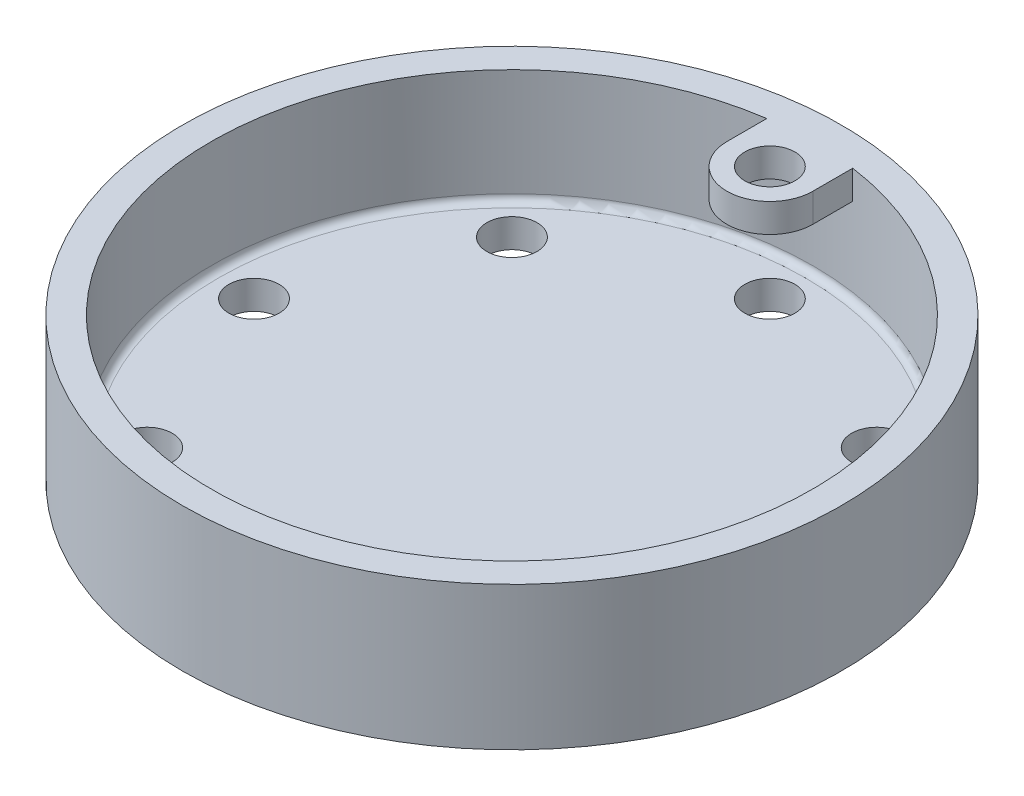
SolidWorks part; units mm, degrees
ref_plane "Front" through (0, 0, 0) normal (0, 0, 1) x (1, 0, 0)
ref_plane "Top" through (0, 0, 0) normal (0, 1, 0) x (1, 0, 0)
ref_plane "Right" through (0, 0, 0) normal (1, 0, 0) x (0, 0, -1)
sketch "Sketch1" plane through (0, 0, 0) normal (0, 1, 0) x (1, 0, 0)
  circle A0 centre (0, 0) radius 73.025
  dimension "D1" = 146.05
  dimension "D2" = 146.05
extrude "Base-Extrude" add sketch "Sketch1" along normal blind 31.75
shell "Shell1" thickness 6.35
sketch "Sketch4" plane through (0, 6.35, 0) normal (0, 1, 0) x (-1, 0, 0)
  line L0 (40.4784, -14.0958) -> (22.1942, -36.669)
  circle A0 centre (0, 0) radius 42.8625
  dimension "D1" = 85.725
extrude "Cut-Extrude2" cut sketch "Sketch4" against normal through all
sketch "Sketch2" plane through (0, 31.75, 0) normal (0, 1, 0) x (-1, 0, 0)
  line L0 (0, -73.025) -> (0, 73.025) construction
  line L1 (-9.525, -65.9911) -> (-9.525, -57.15)
  line L2 (9.525, -57.15) -> (9.525, -65.9911)
  line L3 (50, 0) -> (-50, 0) construction
  circle A0 centre (0, 0) radius 73.025 construction
  arc A1 (-9.525, -65.9911) -> (9.525, -65.9911) centre (0, 0) ccw
  circle A2 centre (0, 0) radius 66.675 construction
  arc A3 (-9.525, -57.15) -> (9.525, -57.15) centre (0, -57.15) cw
  dimension "D2" = 9.525
  dimension "D1" = 57.15
extrude "Boss-Extrude1" add sketch "Sketch2" against normal blind 6.35
sketch "Sketch3" plane through (0, 31.75, 0) normal (0, 1, 0) x (-1, 0, 0)
  circle A0 centre (0, -57.15) radius 5.5563
  arc A1 (9.525, -57.15) -> (-9.525, -57.15) centre (0, -57.15) ccw construction
  dimension "D1" = 11.1125
extrude "Cut-Extrude1" cut sketch "Sketch3" against normal up to next
fillet "Fillet1" radius 50.8
pattern_circular "CirPattern1" count 4 every 90
sketch "Sketch5" plane through (0, 6.35, 0) normal (0, 1, 0) x (-1, 0, 0)
  circle A0 centre (0, -57.15) radius 5.5563 construction
  circle A1 centre (0, -57.15) radius 5.5562
extrude "Cut-Extrude3" cut sketch "Sketch5" against normal through all
pattern_circular "CirPattern2" count 8 every 45 about axis through (0, 0, 0) along (0, 1, 0) of "Cut-Extrude3"
fillet "Fillet2" radius 1.5875 1 edges at (0, 6.35, 66.675)
